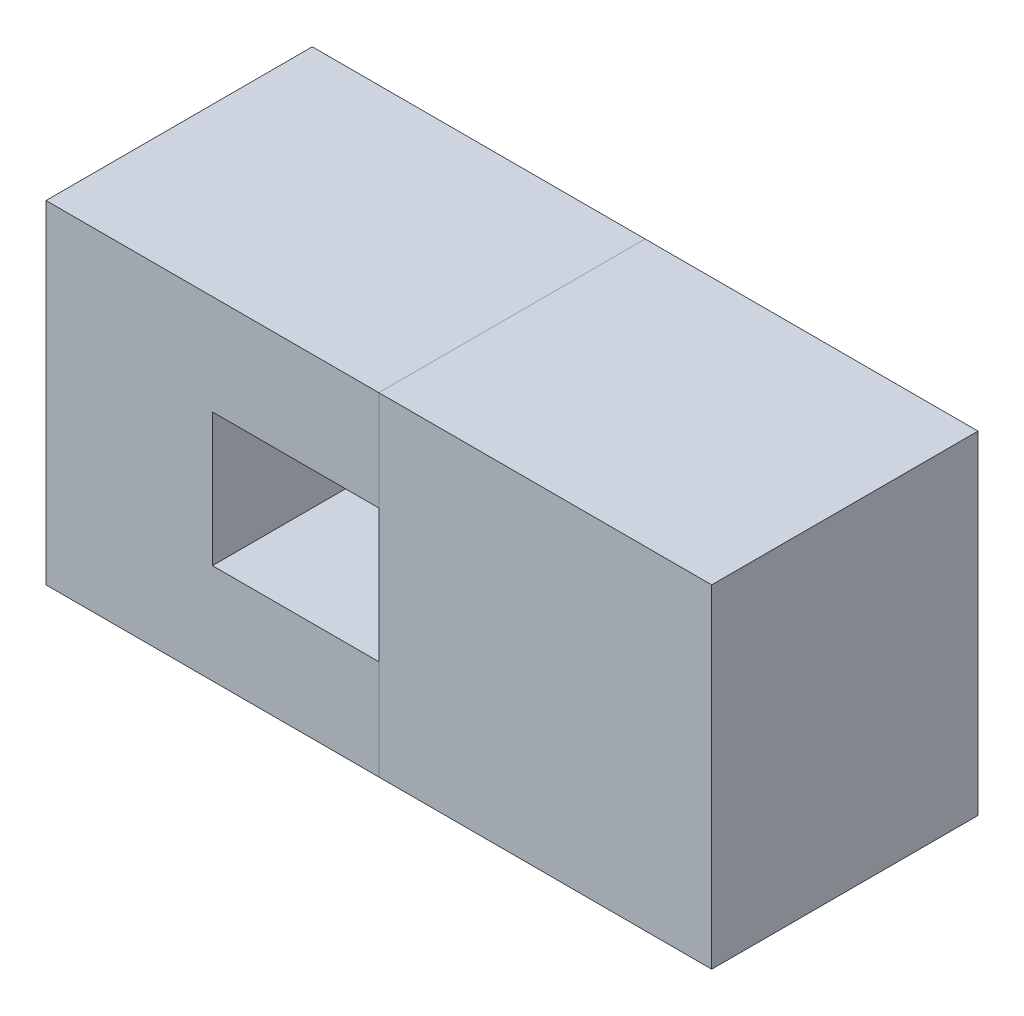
SolidWorks part; units mm, degrees
ref_plane "Ebene vorne" through (0, 0, 0) normal (0, 0, 1) x (1, 0, 0)
ref_plane "Ebene oben" through (0, 0, 0) normal (0, 1, 0) x (1, 0, 0)
ref_plane "Ebene rechts" through (0, 0, 0) normal (1, 0, 0) x (0, 0, -1)
sketch "Skizze1" plane through (0, 0, 0) normal (0, 0, 1) x (1, 0, 0)
  line L0 (50, 50) -> (50, 0) construction
  line L1 (0, 0) -> (100, 0)
  line L2 (0, 0) -> (0, 50)
  line L3 (0, 50) -> (100, 50)
  line L4 (100, 0) -> (100, 50)
  line L5 (25, 35) -> (50, 35)
  line L6 (25, 35) -> (25, 15)
  line L7 (25, 15) -> (50, 15)
  line L8 (50, 35) -> (50, 15)
  line L9 (50, 25) -> (100, 25) construction
  dimension "D1" = 100
  dimension "D2" = 50
  dimension "D3" = 25
  dimension "D4" = 15
extrude "Linear austragen1" add sketch "Skizze1" along normal blind 40
split "Abspalten1" resulting bodies 102 103
